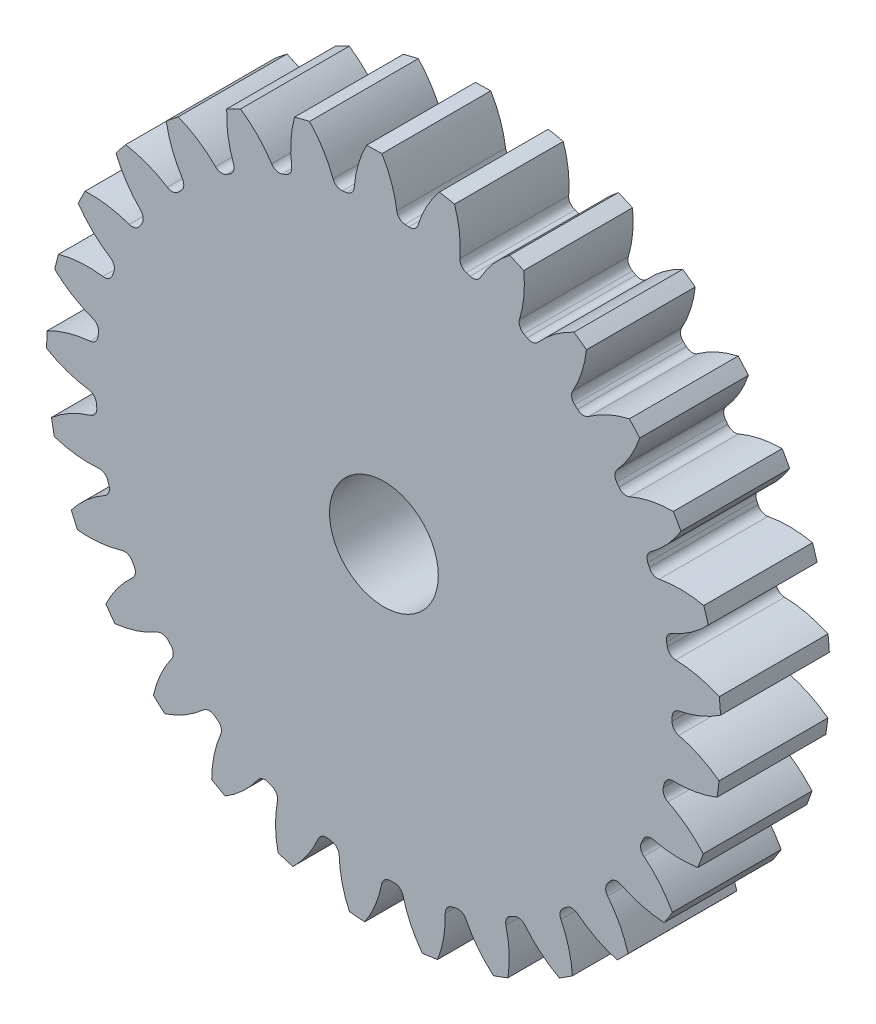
SolidWorks part; units mm, degrees
ref_plane "Front" through (0, 0, 0) normal (0, 0, 1) x (1, 0, 0)
ref_plane "Top" through (0, 0, 0) normal (0, 1, 0) x (1, 0, 0)
ref_plane "Right" through (0, 0, 0) normal (1, 0, 0) x (0, 0, -1)
sketch "Sketch3" plane through (0, 0, 0) normal (0, 0, 1) x (1, 0, 0)
  circle A0 centre (0, 0) radius 314.96
  dimension "od" = 629.92
extrude "gearBody" add sketch "Sketch3" along normal blind 101.6
sketch "Sketch2" plane through (0, 0, 0) normal (0, 0, 1) x (1, 0, 0)
  line L0 (0, 0) -> (255.7955, 105.954) construction
  line L1 (313.566, -35.2988) -> (0, 0) construction
  line L2 (0, 0) -> (36.3143, 0) construction
  line L3 (294.521, 8.3749) -> (293.7083, -23.4126) construction
  line L5 (294.1146, -7.5189) -> (0, 0) construction
  line L7 (0, 0) -> (276.871, 0) construction
  arc A0 (276.8536, 3.1051) -> (276.3333, -17.247) centre (0, 0) ccw construction
  arc A1 (314.3955, 18.8484) -> (313.0218, -34.888) centre (0, 0) ccw construction
  arc A2 (294.521, 8.3749) -> (293.7083, -23.4126) centre (0, 0) ccw construction
  arc A3 (269.0991, -8.7092) -> (269.1926, -5.052) centre (0, 0) ccw
  arc A4 (313.566, -35.2988) -> (275.3702, -17.0027) centre (250.0476, -118.8856) ccw
  arc A5 (313.566, -35.2988) -> (314.96, 19.2308) centre (0, 0) ccw
  arc A6 (314.96, 19.2308) -> (275.8792, 2.9103) centre (255.7955, 105.954) cw
  arc A7 (269.1926, -5.052) -> (275.8792, 2.9103) centre (277.4614, -5.2071) cw
  arc A8 (275.3702, -17.0027) -> (269.0991, -8.7092) centre (277.365, -8.9767) cw
  point P6 (314.96, 19.2308)
  point P22 (313.566, -35.2988)
  dimension "baseDia" = 553.7421
  dimension "od" = 629.92
  dimension "pd" = 589.28
  dimension "rd" = 538.48
  dimension "rFillet" = 8.2702
  dimension "pointX" = 314.96
  dimension "pointY" = 19.2308
  dimension "CTT" = 31.7875
  dimension "flankCenterAngle" = 22.5
extrude "toothCut" cut sketch "Sketch2" along normal through all
pattern_circular "CirPattern1" count 29 over 360 about axis through (0, 0, 0) along (0, 0, 1) of "toothCut"
sketch "hub1Dia" plane through (0, 0, 0) normal (0, 0, -1) x (-1, 0, 0)
  circle A0 centre (0, 0) radius 12.7
  dimension "hub1Dia" = 25.4
sketch "hub2Dia" plane through (0, 0, 101.6) normal (0, 0, 1) x (1, 0, 0)
  circle A0 centre (0, 0) radius 12.7
  dimension "hub2dia" = 25.4
sketch "boreDia" plane through (0, 0, 0) normal (0, 0, 1) x (1, 0, 0)
  circle A0 centre (0, 0) radius 50.8
  dimension "boreDia" = 101.6
extrude "bore" cut sketch "boreDia" against normal mid plane 25400
